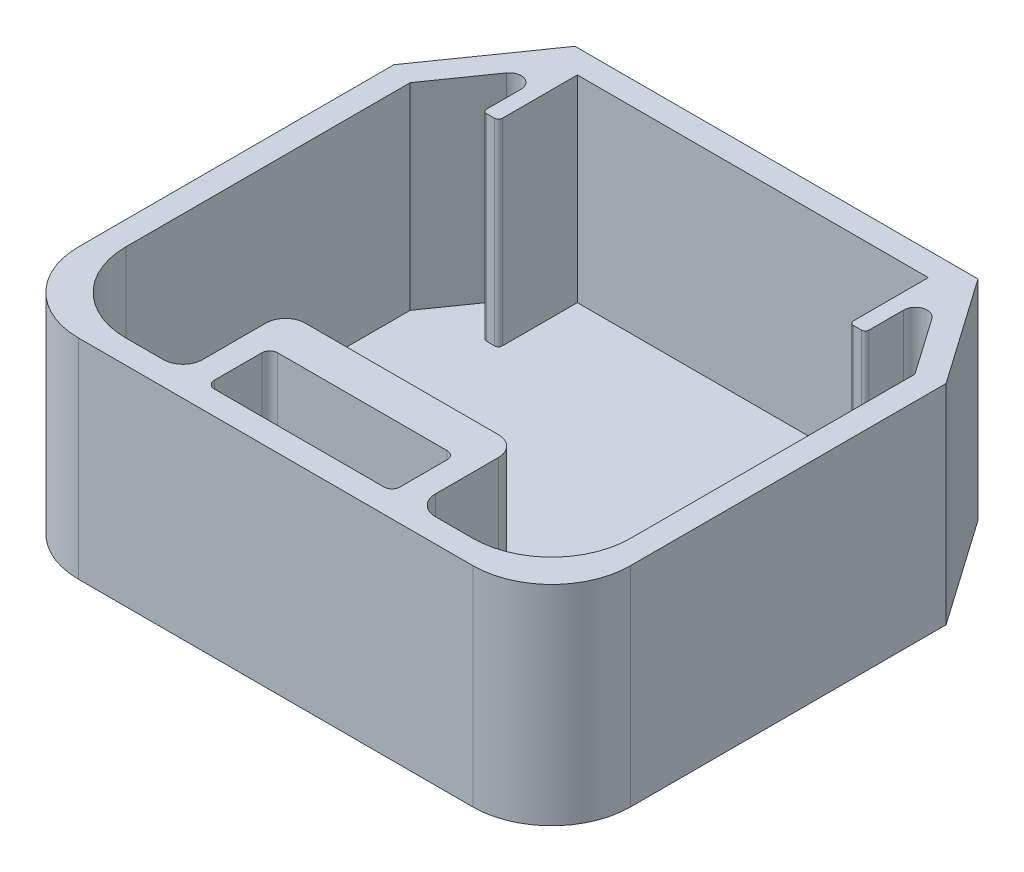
SolidWorks part; units mm, degrees
ref_plane "前视基准面" through (0, 0, 0) normal (0, 0, 1) x (1, 0, 0)
ref_plane "上视基准面" through (0, 0, 0) normal (0, 1, 0) x (1, 0, 0)
ref_plane "右视基准面" through (0, 0, 0) normal (1, 0, 0) x (0, 0, -1)
other "Configuration Table"
sketch "草图1" plane through (0, 0, 0) normal (0, 1, 0) x (1, 0, 0)
  line L0 (5.1094, 6.35) -> (7, 3.65)
  line L1 (-7, -6.35) -> (7, -6.35)
  line L2 (-7, -6.35) -> (-7, 6.35) construction
  line L3 (-7, 6.35) -> (7, 6.35) construction
  line L4 (7, -6.35) -> (7, 6.35) construction
  line L5 (-7, -6.35) -> (7, 6.35) construction
  line L6 (-7, 6.35) -> (7, -6.35) construction
  line L7 (-5.1094, 6.35) -> (-7, 3.65)
  line L8 (5.1094, 6.35) -> (-5.1094, 6.35)
  line L9 (7, 3.65) -> (7, -6.35)
  line L10 (-7, 3.65) -> (-7, -6.35)
  point P0 (0, 0)
  point P10 (0, 6.35)
  dimension "D1" = 14
  dimension "D2" = 12.7
  dimension "D3" = 10
  dimension "D4" = 125
  dimension "D5" = 125
extrude "凸台-拉伸1" add sketch "草图1" along normal blind 0.3
sketch "草图2" plane through (0, 0.3, 0) normal (0, 1, 0) x (1, 0, 0)
  line L0 (-5.1094, 6.35) -> (-7, 3.65)
  line L1 (-7, 3.65) -> (-7, -6.35)
  line L2 (-7, -6.35) -> (7, -6.35)
  line L3 (7, -6.35) -> (7, 3.65)
  line L4 (7, 3.65) -> (5.1094, 6.35)
  line L5 (5.1094, 6.35) -> (-5.1094, 6.35)
  line L6 (-4.7971, 5.75) -> (-6.4, 3.4608)
  line L7 (-6.4, 3.4608) -> (-6.4, -5.75)
  line L8 (-6.4, -5.75) -> (6.4, -5.75)
  line L9 (6.4, -5.75) -> (6.4, 3.4608)
  line L10 (6.4, 3.4608) -> (4.7971, 5.75)
  line L11 (4.7971, 5.75) -> (-4.7971, 5.75)
  dimension "D1" = 0.6
extrude "凸台-拉伸2" add sketch "草图2" along normal blind 5
sketch "草图3" plane through (0, 5.3, 0) normal (0, 1, 0) x (1, 0, 0)
  line L0 (-5.1094, 6.35) -> (-7, 3.65)
  line L1 (-7, 3.65) -> (-7, -6.35)
  line L2 (-7, -6.35) -> (7, -6.35)
  line L3 (7, -6.35) -> (7, 3.65)
  line L4 (7, 3.65) -> (5.1094, 6.35) construction
  line L5 (7, 3.65) -> (5.1094, 6.35)
  line L6 (5.1094, 6.35) -> (-5.1094, 6.35)
extrude "凸台-拉伸3" [suppressed] add sketch "草图3" along normal blind 0.3
fillet "圆角2" radius 2 4 edges at (6.4, 2.8, 5.75) (-6.4, 2.8, 5.75) (-7, 2.65, 6.35) (7, 2.65, 6.35)
sketch "草图4" plane through (0, 5.3, 0) normal (0, 1, 0) x (1, 0, 0)
  line L0 (-2.35, -5.75) -> (-2.35, -4.15)
  line L1 (-4.4, -5.75) -> (4.4, -5.75) construction
  line L2 (-2.35, -4.15) -> (2.35, -4.15)
  line L3 (2.35, -4.15) -> (2.35, -5.75)
  line L4 (-4.4, -5.75) -> (4.4, -5.75) construction
  line L5 (2.35, -5.75) -> (2.95, -5.75)
  line L6 (2.95, -5.75) -> (2.95, -3.15)
  line L7 (2.95, -3.15) -> (-2.95, -3.15)
  line L8 (-2.95, -3.15) -> (-2.95, -5.75)
  line L9 (-2.95, -5.75) -> (-2.35, -5.75)
  line L10 (-4.7971, 5.75) -> (4.7971, 5.75) construction
  point P16 (0, 5.75)
  point P17 (0, -3.15)
  point P18 (0, -4.15)
  dimension "D1" = 4.7
  dimension "D2" = 0.6
  dimension "D3" = 1.6
  dimension "D4" = 1
extrude "凸台-拉伸4" add sketch "草图4" against normal up to surface (5 mm away)
fillet "圆角3" radius 0.5 4 edges at (-2.95, 2.8, 5.75) (2.95, 2.8, 5.75) (2.95, 2.8, 3.15) (-2.95, 2.8, 3.15)
fillet "圆角4" radius 0.2 4 edges at (2.35, 2.8, 5.75) (-2.35, 2.8, 5.75) (-2.35, 2.8, 4.15) (2.35, 2.8, 4.15)
sketch "草图5" plane through (0, 0.3, 0) normal (0, 1, 0) x (1, 0, 0)
  line L0 (-4.85, 5.75) -> (-4.85, 3.75)
  line L1 (4.7971, 5.75) -> (-4.7971, 5.75) construction
  line L2 (-4.45, 5.75) -> (-4.45, 3.75)
  line L3 (4.45, 3.75) -> (4.45, 5.75)
  line L4 (4.7971, 5.75) -> (-4.7971, 5.75) construction
  line L5 (4.45, 5.75) -> (4.85, 5.75)
  line L6 (4.85, 5.75) -> (4.85, 3.75)
  line L7 (-4.85, 5.75) -> (-4.45, 5.75)
  line L8 (-4.85, 3.75) -> (-4.45, 3.75)
  line L9 (4.45, 3.75) -> (4.85, 3.75)
  line L10 (-4.45, 5.75) -> (4.45, 5.75) construction
  line L11 (-6.4, -0.1446) -> (6.4, -0.1446) construction
  line L12 (-6.4, 3.4608) -> (-6.4, -3.75) construction
  line L13 (6.4, -3.75) -> (6.4, 3.4608) construction
  point P18 (0, -0.1446)
  point P19 (0, 5.75)
  dimension "D1" = 0.4
  dimension "D2" = 0.4
  dimension "D3" = 8.9
  dimension "D4" = 2
  dimension "D5" = 2
extrude "凸台-拉伸5" add sketch "草图5" along normal up to surface (5 mm away)
fillet "圆角5" radius 0.3 2 edges at (4.85, 2.8, -5.6745) (-4.85, 2.8, -5.6745)
fillet "圆角7" radius 0.1 4 edges at (4.85, 2.8, -3.75) (4.45, 2.8, -3.75) (-4.45, 2.8, -3.75) (-4.85, 2.8, -3.75)
